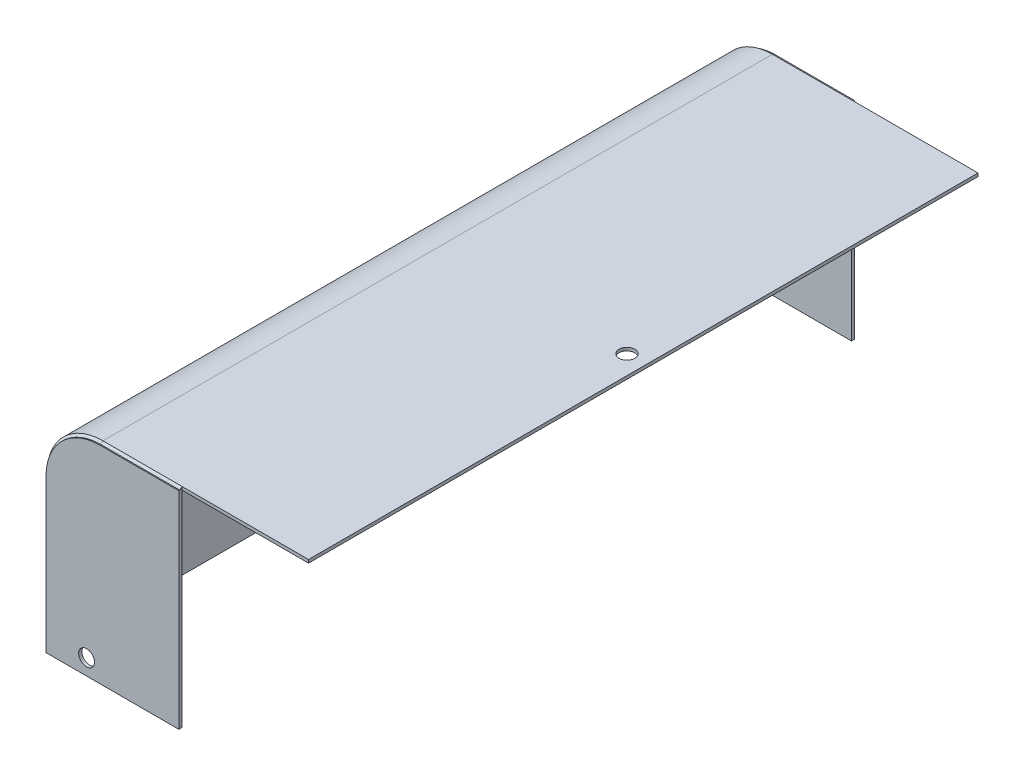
SolidWorks part; units mm, degrees
other "Objet de détail2"
other "Objet de détail3"
ref_plane "Face" through (0, 0, 0) normal (0, 0, 1) x (1, 0, 0)
ref_plane "Dessus" through (0, 0, 0) normal (0, 1, 0) x (1, 0, 0)
ref_plane "Droite" through (0, 0, 0) normal (1, 0, 0) x (0, 0, -1)
sketch "Esquisse1" plane through (0, 0, 0) normal (0, 0, 1) x (1, 0, 0)
  line L0 (-32.3473, -130.3539) -> (-32.3473, 14.6461)
  line L1 (20.6527, 67.6461) -> (215.6527, 67.6461)
  line L2 (-29.3473, -130.3539) -> (-29.3473, 14.6461)
  line L3 (20.6527, 64.6461) -> (215.6527, 64.6461)
  line L4 (215.6527, 67.6461) -> (215.6527, 64.6461)
  line L5 (-32.3473, -130.3539) -> (-29.3473, -130.3539)
  arc A0 (-29.3473, 14.6461) -> (20.6527, 64.6461) centre (20.6527, 14.6461) cw
  arc A1 (-32.3473, 14.6461) -> (20.6527, 67.6461) centre (20.6527, 14.6461) cw
  point P5 (-29.3473, 64.6461)
  dimension "D3" = 50
  dimension "D1" = 245
  dimension "D2" = 195
  dimension "D4" = 3
extrude "Extrusion1" add sketch "Esquisse1" along normal blind 635
sketch "Esquisse2" plane through (0, 0, 635) normal (0, 0, 1) x (1, 0, 0)
  line L0 (-30.3473, -130.3539) -> (95.6527, -130.3539)
  line L2 (95.6527, -130.3539) -> (95.6527, 65.6461)
  line L4 (95.6527, 65.6461) -> (20.6527, 65.6461)
  line L5 (-30.3473, 14.6461) -> (-30.3473, -130.3539)
  line L6 (-32.3473, 14.6461) -> (-32.3473, -130.3539) construction
  line L7 (215.6527, 67.6461) -> (20.6527, 67.6461) construction
  arc A0 (-30.3473, 14.6461) -> (20.6527, 65.6461) centre (20.6527, 14.6461) cw
  dimension "D4" = 51
  dimension "D1" = 126
  dimension "D2" = 2
  dimension "D3" = 2
extrude "Extrusion2" add sketch "Esquisse2" along normal blind 3 separate body
sketch "Esquisse3" plane through (0, 0, 0) normal (0, 0, -1) x (-1, 0, 0)
  line L0 (-95.6527, -130.3539) -> (30.3473, -130.3539)
  line L1 (30.3473, -130.3539) -> (-95.6527, -130.3539) construction
  line L2 (32.3473, 14.6461) -> (32.3473, -130.3539) construction
  line L3 (-95.6527, -130.3539) -> (-95.6527, 65.6461)
  line L4 (-95.6527, -130.3539) -> (-95.6527, 65.6461) construction
  line L5 (-215.6527, 67.6461) -> (-20.6527, 67.6461) construction
  line L6 (-95.6527, 65.6461) -> (-20.6527, 65.6461)
  line L7 (30.3473, -130.3539) -> (30.3473, 14.6461)
  arc A0 (-20.6527, 65.6461) -> (30.3473, 14.6461) centre (-20.6527, 14.6461) cw
  dimension "D4" = 51
  dimension "D1" = 126
  dimension "D2" = 128
  dimension "D3" = 2
extrude "Extrusion3" add sketch "Esquisse3" along normal blind 3 separate body
other "Cordon de soudure d'angle2" parameters "D10"=6, "D11"=2, "D12"=0, "D13"=3, "D14"=0
other "Cordon de soudure d'angle3" parameters "D10"=6, "D11"=2, "D12"=0, "D13"=3, "D14"=0
sketch "Esquisse5" plane through (0, 67.6461, 0) normal (0, 1, 0) x (-1, 0, 0)
  line L0 (-215.6527, 0) -> (-20.6527, 0) construction
  line L1 (-215.6527, 635) -> (-215.6527, 0) construction
  circle A0 centre (-197.6527, 315) radius 7.5
  dimension "D1" = 15
  dimension "D4" = 315
  dimension "D5" = 18
extrude "Enlèv. mat.-Extru.1" cut sketch "Esquisse5" against normal blind 3
sketch "Esquisse6" plane through (0, 0, 638) normal (0, 0, 1) x (1, 0, 0)
  line L0 (-30.3473, -130.3539) -> (95.6527, -130.3539) construction
  line L1 (95.6527, -130.3539) -> (95.6527, 65.6461) construction
  circle A0 centre (8.1527, -115.3539) radius 7.5
  dimension "D1" = 15
  dimension "D2" = 15
  dimension "D3" = 87.5
extrude "Enlèv. mat.-Extru.2" cut sketch "Esquisse6" against normal through all
